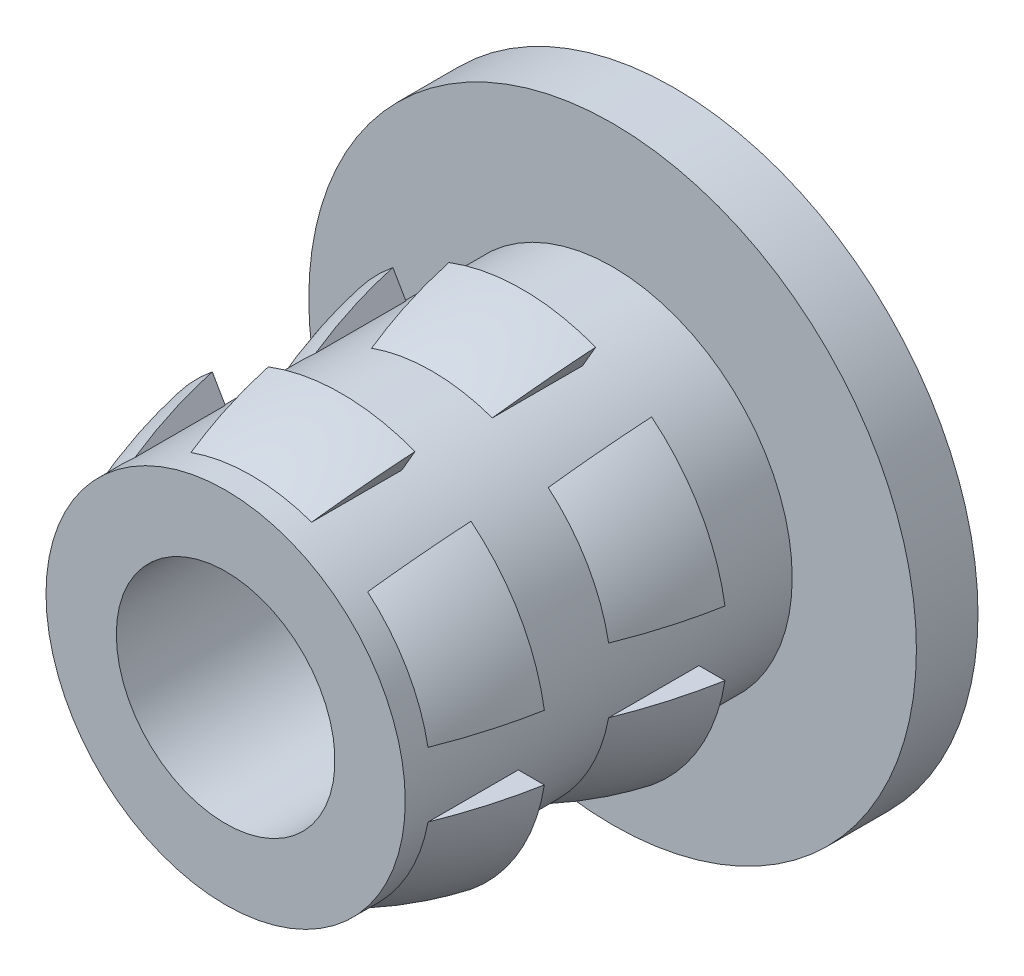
SolidWorks part; units mm, degrees
other "<flanged insert 6-32 S1>"
ref_plane "Front Plane" through (0, 0, 0) normal (0, 0, 1) x (1, 0, 0)
ref_plane "Top Plane" through (0, 0, 0) normal (0, 1, 0) x (1, 0, 0)
ref_plane "Right Plane" through (0, 0, 0) normal (1, 0, 0) x (0, 0, -1)
inserted part "flanged insert 6-32 S1"
